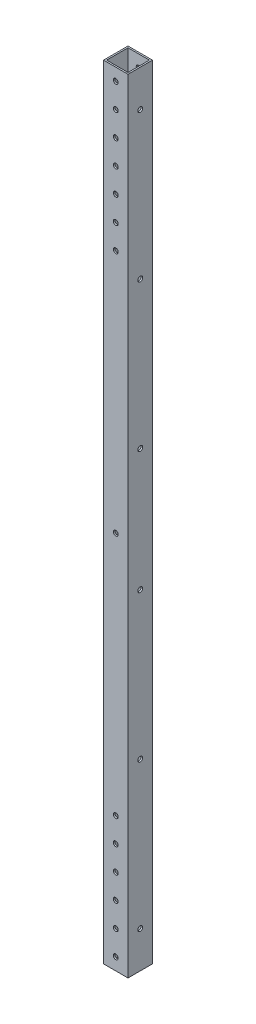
SolidWorks part; units mm, degrees
ref_plane "Front Plane" through (0, 0, 0) normal (0, 0, 1) x (1, 0, 0)
ref_plane "Top Plane" through (0, 0, 0) normal (0, 1, 0) x (1, 0, 0)
ref_plane "Right Plane" through (0, 0, 0) normal (1, 0, 0) x (0, 0, -1)
sketch "Sketch1" plane through (0, 0, 0) normal (0, 1, 0) x (1, 0, 0)
  line L1 (-12.7, -12.7) -> (12.7, -12.7)
  line L2 (-12.7, -12.7) -> (-12.7, 12.7)
  line L3 (-12.7, 12.7) -> (12.7, 12.7)
  line L4 (12.7, -12.7) -> (12.7, 12.7)
  line L5 (-12.7, -12.7) -> (12.7, 12.7) construction
  line L6 (-12.7, 12.7) -> (12.7, -12.7) construction
  line L7 (-11.1125, -11.1125) -> (11.1125, -11.1125)
  line L8 (-11.1125, -11.1125) -> (-11.1125, 11.1125)
  line L9 (-11.1125, 11.1125) -> (11.1125, 11.1125)
  line L10 (11.1125, -11.1125) -> (11.1125, 11.1125)
  line L11 (-11.1125, -11.1125) -> (11.1125, 11.1125) construction
  line L12 (-11.1125, 11.1125) -> (11.1125, -11.1125) construction
  point P0 (0, 0)
  point P6 (0, 0)
  dimension "D1" = 25.4
  dimension "D2" = 1.5875
extrude "Boss-Extrude1" add sketch "Sketch1" along normal blind 812.8
hole_wizard "#7 (0.201) Diameter Hole1" positions "Sketch2" profile "Sketch3" hole size "#7" standard "ANSI Inch"
sketch "Sketch2" plane through (0, 0, 12.7) normal (0, 0, 1) x (1, 0, 0)
  line L0 (-12.7, 0) -> (12.7, 0) construction
  point P0 (0, 12.7)
  point P12 (0, 38.1)
  point P13 (0, 63.5)
  point P14 (0, 88.9)
  point P15 (0, 114.3)
  point P16 (0, 139.7)
  point P26 (0, 393.7)
  point P36 (0, 647.7)
  point P37 (0, 673.1)
  point P38 (0, 698.5)
  point P39 (0, 723.9)
  point P40 (0, 749.3)
  point P41 (0, 774.7)
  point P42 (0, 800.1)
  point P43 (0, 165.1)
  point P44 (0, 622.3)
  point P45 (0, 368.3)
  point P46 (0, 342.9)
  point P47 (0, 317.5)
  point P48 (0, 292.1)
  point P49 (0, 266.7)
  point P50 (0, 241.3)
  point P51 (0, 215.9)
  point P52 (0, 190.5)
  point P53 (0, 596.9)
  point P54 (0, 571.5)
  point P55 (0, 546.1)
  point P56 (0, 520.7)
  point P57 (0, 495.3)
  point P58 (0, 469.9)
  point P59 (0, 444.5)
  point P60 (0, 419.1)
  dimension "D1" = 12.7
  dimension "D3" = 25.4
  dimension "D2" = 32
sketch "Sketch3" plane through (0, 12.7, 12.7) normal (1, 0, 0) x (0, -1, 0)
  line L0 (0, 0) -> (0, 25.4)
  line L1 (0, 25.4) -> (2.5527, 25.4)
  line L2 (2.5527, 25.4) -> (2.5527, 0)
  line L5 (2.5527, 0) -> (0, 0)
  line L11 (0, -6.35) -> (0, 107.95) construction
  dimension "Thru Hole Dia." = 5.1054
  dimension "Thru Hole Depth" = 25.4
hole_wizard "#7 (0.201) Diameter Hole2" positions "Sketch4" profile "Sketch5" hole size "#7" standard "ANSI Inch"
sketch "Sketch4" plane through (12.7, 0, 0) normal (1, 0, 0) x (0, 0, -1)
  line L0 (-12.7, 0) -> (12.7, 0) construction
  point P0 (0, 38.1)
  point P17 (0, 190.5)
  point P23 (0, 342.9)
  point P28 (0, 469.9)
  point P34 (0, 622.3)
  point P40 (0, 774.7)
  point P46 (0, 165.1)
  point P47 (0, 139.7)
  point P48 (0, 114.3)
  point P49 (0, 88.9)
  point P50 (0, 63.5)
  point P52 (0, 317.5)
  point P53 (0, 292.1)
  point P54 (0, 266.7)
  point P55 (0, 241.3)
  point P56 (0, 215.9)
  point P57 (0, 444.5)
  point P58 (0, 419.1)
  point P59 (0, 393.7)
  point P60 (0, 368.3)
  point P61 (0, 596.9)
  point P62 (0, 571.5)
  point P63 (0, 546.1)
  point P64 (0, 520.7)
  point P65 (0, 495.3)
  point P66 (0, 749.3)
  point P67 (0, 723.9)
  point P68 (0, 698.5)
  point P69 (0, 673.1)
  point P70 (0, 647.7)
  dimension "D1" = 38.1
  dimension "D3" = 152.4
  dimension "D2" = 30
sketch "Sketch5" plane through (12.7, 38.1, 0) normal (0, 1, 0) x (0, 0, -1)
  line L0 (0, 0) -> (0, 25.4)
  line L1 (0, 25.4) -> (2.5527, 25.4)
  line L2 (2.5527, 25.4) -> (2.5527, 0)
  line L5 (2.5527, 0) -> (0, 0)
  line L11 (0, -6.35) -> (0, 107.95) construction
  dimension "Thru Hole Dia." = 5.1054
  dimension "Thru Hole Depth" = 25.4
